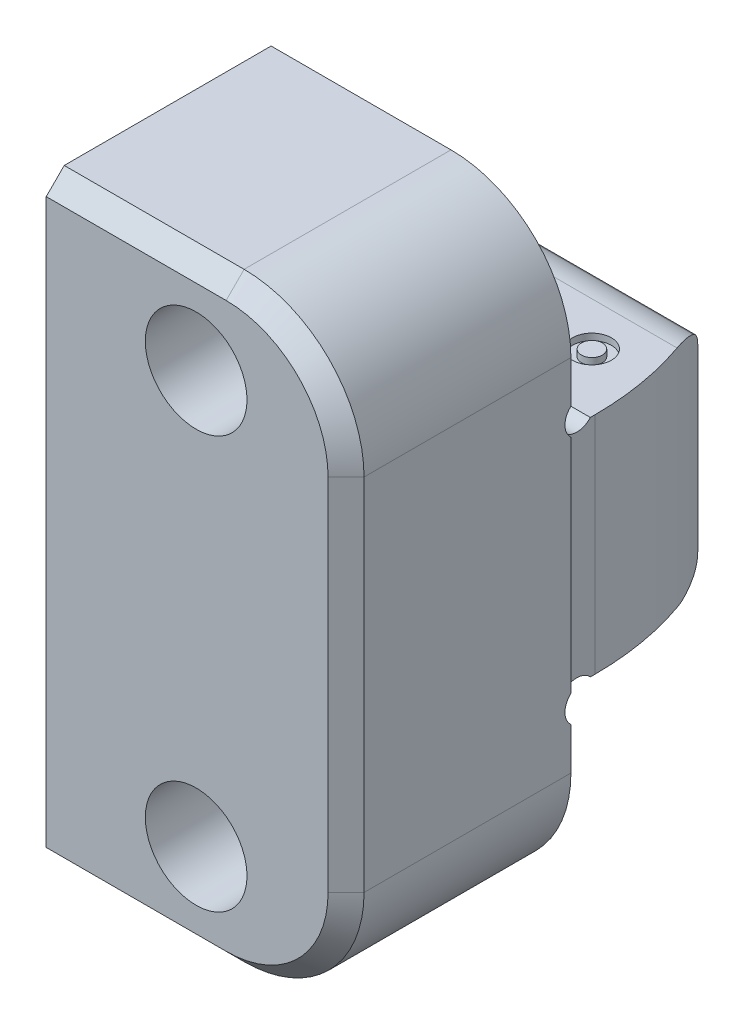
SolidWorks part; units mm, degrees
ref_plane "Front Plane" through (0, 0, 0) normal (0, 0, 1) x (1, 0, 0)
ref_plane "Top Plane" through (0, 0, 0) normal (0, 1, 0) x (1, 0, 0)
ref_plane "Right Plane" through (0, 0, 0) normal (1, 0, 0) x (0, 0, -1)
sketch "Sketch2" plane through (0, 0, 0) normal (1, 0, 0) x (0, 0, -1)
  line L0 (0, 4.76) -> (0, 12.7)
  line L1 (0, 12.7) -> (-9.525, 12.7)
  line L2 (-9.525, 12.7) -> (-9.525, -12.7)
  line L3 (0, 4.76) -> (6.985, 4.76)
  line L4 (6.985, 4.76) -> (6.985, -4.76)
  line L5 (19.1765, 0) -> (-19.65, 0) construction
  line L6 (0, -12.7) -> (-9.525, -12.7)
  line L7 (0, -4.76) -> (0, -12.7)
  line L8 (0, -4.76) -> (6.985, -4.76)
  point P11 (-9.525, 0)
  point P14 (6.985, 0)
  dimension "D1" = 9.525
  dimension "D2" = 6.985
  dimension "D3" = 25.4
  dimension "D4" = 9.5199
extrude "Boss-Extrude2" add sketch "Sketch2" along normal mid plane 12.7
hole_wizard "CBORE for #6 Socket Head Cap Screw1" positions "Sketch4" profile "Sketch3" counterbore size "#6" standard "ANSI Inch"
sketch "Sketch4" plane through (0, 0, 0) normal (0, 0, -1) x (-1, 0, 0)
  line L0 (-3.0198, 0) -> (4.3009, 0) construction
  point P0 (0, 8.7312)
  point P8 (0, -8.7312)
  dimension "D1" = 17.4625
sketch "Sketch3" plane through (0, 8.7312, 0) normal (1, 0, 0) x (0, 1, 0)
  line L0 (0, 0) -> (0, 9.525)
  line L1 (0, 9.525) -> (2.1526, 9.525)
  line L3 (2.1526, 9.525) -> (2.1526, 4.2672)
  line L4 (2.1526, 4.2672) -> (3.175, 4.2672)
  line L5 (3.175, 4.2672) -> (3.175, 0)
  line L7 (3.175, 0) -> (0, 0)
  line L11 (0, -6.35) -> (0, 107.95) construction
  dimension "Thru Hole Dia." = 4.3053
  dimension "Thru Hole Depth" = 9.525
  dimension "C'Bore Dia." = 6.35
  dimension "C'Bore Depth" = 4.2672
fillet "Fillet1" radius 5.08 2 edges at (6.35, -12.7, 4.7625) (6.35, 12.7, 4.7625)
chamfer "Chamfer1" distance 0.762 angle 45 6 edges at (-6.35, 0, 9.525) (-2.54, -12.7, 9.525) (4.8621, -11.2121, 9.525) (6.35, 0, 9.525) (-2.54, 12.7, 9.525) (4.8621, 11.2121, 9.525)
sketch "Sketch5" plane through (6.35, 0, 0) normal (1, 0, 0) x (0, 0, -1)
  line L0 (6.985, 4.76) -> (5.461, 4.76)
  line L1 (6.985, 4.76) -> (0, 4.76) construction
  line L2 (6.985, -4.76) -> (6.985, 4.76) construction
  line L3 (6.985, 3.7938) -> (6.985, 4.76)
  line L4 (-2.2527, 0) -> (10.514, 0) construction
  line L5 (6.985, -3.7938) -> (6.985, -4.76)
  line L6 (6.985, -4.76) -> (5.461, -4.76)
  arc A0 (5.461, 4.76) -> (6.604, 4.4537) centre (5.461, 2.474) cw
  arc A1 (6.604, 4.4537) -> (6.985, 3.7938) centre (6.223, 3.7938) cw
  arc A2 (6.604, -4.4537) -> (6.985, -3.7938) centre (6.223, -3.7938) ccw
  arc A3 (5.461, -4.76) -> (6.604, -4.4537) centre (5.461, -2.474) ccw
  dimension "D2" = 0.762
  dimension "D3" = 2.286
  dimension "D1" = 1.524
  dimension "D4" = 0.3063
extrude "Cut-Extrude1" cut sketch "Sketch5" against normal through all
sketch "Sketch7" plane through (0, 4.76, 0) normal (0, 1, 0) x (1, 0, 0)
  line L0 (6.35, 6.604) -> (6.35, 6.985) construction
  line L2 (-6.35, 6.985) -> (6.35, 6.985) construction
  line L3 (4.7375, 6.985) -> (6.35, 6.985)
  line L4 (6.35, 6.985) -> (6.35, 0)
  line L5 (6.35, 0) -> (6.096, 0)
  line L7 (6.096, 0) -> (6.096, 1.27)
  arc A0 (6.096, 1.27) -> (4.7375, 6.985) centre (-6.604, 1.27) ccw
  dimension "D2" = 12.7
  dimension "D1" = 1.27
  dimension "D3" = 0.254
extrude "Cut-Extrude3" cut sketch "Sketch7" against normal through all
sketch "Sketch6" plane through (6.35, 0, 0) normal (1, 0, 0) x (0, 0, -1)
  line L0 (5.461, 4.76) -> (0, 4.76) construction
  line L1 (0, -7.62) -> (0, 7.62) construction
  line L2 (0, 0) -> (2.587, 0) construction
  circle A0 centre (0.508, 5.268) radius 0.762
  circle A1 centre (0.508, -5.268) radius 0.762
  dimension "D1" = 1.524
  dimension "D2" = 0.508
  dimension "D3" = 0.508
extrude "Cut-Extrude2" cut sketch "Sketch6" against normal through all
sketch "Sketch9" plane through (0, 4.76, 0) normal (0, 1, 0) x (1, 0, 0)
  circle A0 centre (-4.0005, 3.6195) radius 0.8255
  circle A1 centre (-1.4605, 3.6195) radius 0.8255
  circle A2 centre (1.0795, 3.6195) radius 0.8255
  circle A3 centre (3.6195, 3.6195) radius 0.8255
  circle A6 centre (-4.0005, 3.6195) radius 0.4445
  circle A7 centre (-1.4605, 3.6195) radius 0.4445
  circle A8 centre (1.0795, 3.6195) radius 0.4445
  circle A9 centre (3.6195, 3.6195) radius 0.4445
  dimension "D4" = 4
extrude "Cut-Extrude5" cut sketch "Sketch9" against normal blind 0.2794
mirror "Mirror2" about plane through (0, 0, 0) normal (0, 1, 0) of "Cut-Extrude5"
